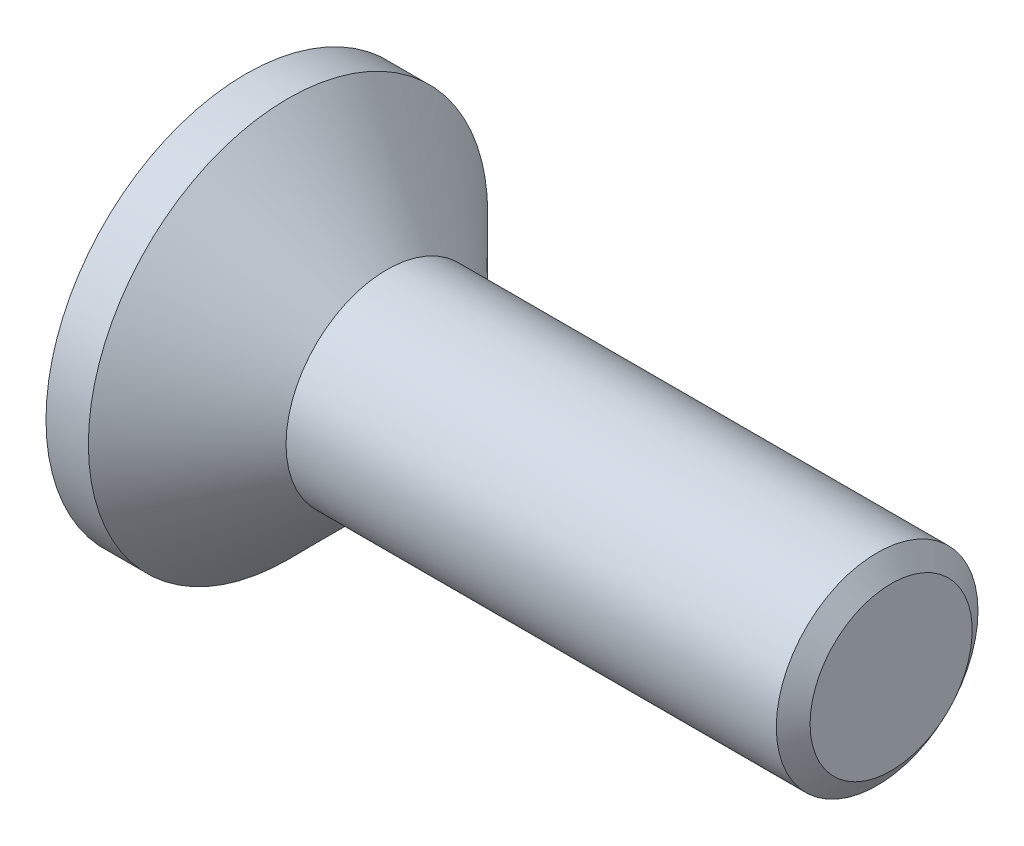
SolidWorks part; units mm, degrees
ref_plane "Plan de face" through (0, 0, 0) normal (0, 0, 1) x (1, 0, 0)
ref_plane "Plan de dessus" through (0, 0, 0) normal (0, 1, 0) x (1, 0, 0)
ref_plane "Plan de droite" through (0, 0, 0) normal (1, 0, 0) x (0, 0, -1)
ref_plane "Plan1" through (16, 0, 0) normal (1, 0, 0) x (0, 0, -1)
sketch "Esquisse1" plane through (0, 0, 0) normal (0, 1, 0) x (1, 0, 0)
  line L0 (0.5, 0) -> (0.5, 1.6667)
  line L1 (0.5, 1.6667) -> (0, 1.6667)
  line L2 (0, 1.6667) -> (0, 4.95)
  line L3 (0, 4.95) -> (1.05, 4.95)
  line L4 (1.05, 4.95) -> (3.5, 2.5)
  line L5 (3.5, 2.5) -> (15.6532, 2.5)
  line L6 (15.6532, 2.5) -> (16, 2.0095)
  line L7 (16, 2.0095) -> (16, 0)
  line L8 (16, 0) -> (0.5, 0)
  line L9 (16, 0) -> (0, 0) construction
revolve "Révolution1" add sketch "Esquisse1" angle 360 about L9
sketch "Esquisse2" plane through (0, 0, 0) normal (0, 0, 1) x (1, 0, 0)
  line L0 (-0.1, 0) -> (-0.1, 2.35)
  line L1 (-0.1, 2.35) -> (0.045, 2.35)
  line L2 (0.045, 2.35) -> (0.6747, 0)
  line L3 (0.6747, 0) -> (-0.1, 0)
  line L4 (0.6747, 0) -> (-0.1, 0) construction
revolve "Enlèvement de matière-Révolution1" cut sketch "Esquisse2" angle 360 about L4
sketch "Esquisse3" plane through (0, 0, 0) normal (1, 0, 0) x (0, 0, -1)
  arc A0 (-1.9123, 0.4398) -> (-1.9123, -0.4398) centre (-1.808, 0) ccw
  arc A1 (-1.9123, -0.4398) -> (-1.337, -1.4362) centre (-2.0948, -1.2095) cw
  arc A2 (-1.337, -1.4362) -> (-0.5753, -1.876) centre (-0.904, -1.5658) ccw
  arc A3 (-0.5753, -1.876) -> (0.5753, -1.876) centre (0, -2.4189) cw
  arc A4 (0.5753, -1.876) -> (1.337, -1.4362) centre (0.904, -1.5658) ccw
  arc A5 (1.337, -1.4362) -> (1.9123, -0.4398) centre (2.0948, -1.2095) cw
  arc A6 (1.9123, -0.4398) -> (1.9123, 0.4398) centre (1.808, 0) ccw
  arc A7 (1.9123, 0.4398) -> (1.337, 1.4362) centre (2.0948, 1.2095) cw
  arc A8 (1.337, 1.4362) -> (0.5753, 1.876) centre (0.904, 1.5658) ccw
  arc A9 (0.5753, 1.876) -> (-0.5753, 1.876) centre (0, 2.4189) cw
  arc A10 (-0.5753, 1.876) -> (-1.337, 1.4362) centre (-0.904, 1.5658) ccw
  arc A11 (-1.337, 1.4362) -> (-1.9123, 0.4398) centre (-2.0948, 1.2095) cw
sketch "Esquisse4" plane through (0.5, 0, 0) normal (-1, 0, 0) x (0, 0, 1)
  circle A0 centre (0, 0) radius 0.7533
extrude "Enlèv. mat.-Extru.1" cut sketch "Esquisse3" along normal blind 1.75
extrude "Extrusion1" add sketch "Esquisse4" against normal blind 1.75
